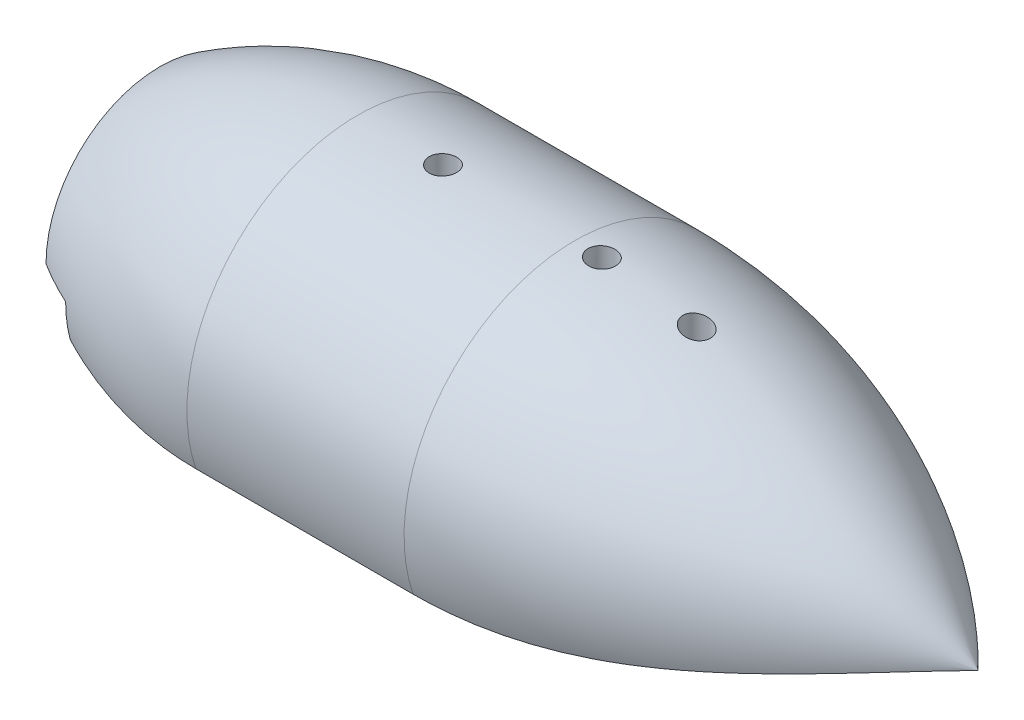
SolidWorks part; units mm, degrees
ref_plane "Front Plane" through (0, 0, 0) normal (0, 0, 1) x (1, 0, 0)
ref_plane "Top Plane" through (0, 0, 0) normal (0, 1, 0) x (1, 0, 0)
ref_plane "Right Plane" through (0, 0, 0) normal (1, 0, 0) x (0, 0, -1)
sketch "Sketch2" plane through (0, 0, 0) normal (1, 0, 0) x (0, 0, -1)
  circle A0 centre (0, 0) radius 18.288
  dimension "D1" = 36.576
extrude "Extrude1" add sketch "Sketch2" along normal blind 87.63
sketch "Sketch3" plane through (0, 0, 0) normal (0, 0, 1) x (1, 0, 0)
  line L0 (87.63, -18.288) -> (87.63, 18.288) construction
  line L2 (44.45, 0) -> (44.45, 18.288) construction
  line L3 (87.63, 18.288) -> (0, 18.288) construction
  line L4 (87.63, 0.0088) -> (87.63, 18.288)
  line L5 (87.63, 18.288) -> (44.45, 18.288)
  line L6 (0, 0) -> (21.1849, 0) construction
  line L7 (21.1849, 0) -> (21.1849, 18.288) construction
  line L8 (0, 0) -> (0, 12.192) construction
  line L9 (0, 18.288) -> (0, -18.288) construction
  line L10 (21.1849, 18.288) -> (0, 18.288)
  line L11 (0, 18.288) -> (0, 12.192)
  arc A0 (44.45, 18.288) -> (87.63, 0.0088) centre (44.45, -41.8525) cw
  arc A1 (21.1849, 18.288) -> (0, 12.192) centre (21.1849, -21.5709) ccw
  dimension "D1" = 12.192
revolve "shape" cut sketch "Sketch3" angle 360 about L6
sketch "Sketch5" plane through (0, 0, 0) normal (-1, 0, 0) x (0, 0, 1)
  circle A0 centre (0, 0) radius 7.9375
  dimension "D1" = 15.875
extrude "Cut-Extrude2" cut sketch "Sketch5" against normal blind 24.13
sketch "Sketch4" plane through (0, 0, 0) normal (-1, 0, 0) x (0, 0, 1)
  line L0 (0, -20.6375) -> (0, 0) construction
  line L1 (16.3949, -8.103) -> (-16.3949, -8.103)
  line L2 (0, -20.6375) -> (16.3949, -8.103) construction
  line L3 (16.3949, -8.103) -> (16.3949, -20.6375)
  line L4 (16.3949, -20.6375) -> (-16.3949, -20.6375)
  line L5 (-16.3949, -20.6375) -> (-16.3949, -8.103)
  circle A1 centre (0, 0) radius 18.288 construction
  dimension "D1" = 20.6375
  dimension "D2" = 20.6375
extrude "Cut-Extrude1" cut sketch "Sketch4" against normal through all
sketch "Sketch8" plane through (0, 0, 0) normal (0, 1, 0) x (1, 0, 0)
  line L0 (26.2128, 3.2946) -> (26.2128, 11.8036)
  line L1 (26.2128, 3.2946) -> (34.4678, 3.2946)
  line L2 (18.923, 11.8036) -> (26.2128, 11.8036)
  line L3 (26.2128, -3.3094) -> (34.4678, -3.3094)
  line L4 (18.923, 11.8036) -> (18.923, -11.8184)
  line L5 (18.923, -11.8184) -> (26.2128, -11.8184)
  line L6 (26.2128, -11.8184) -> (26.2128, -3.3094)
  line L7 (34.4678, 11.8036) -> (42.3418, 11.8036)
  line L8 (34.4678, -11.8184) -> (34.4678, -3.3094)
  line L9 (34.4678, -11.8184) -> (42.3418, -11.8184)
  line L10 (42.3418, 11.8036) -> (42.3418, -11.8184)
  line L11 (34.4678, 3.2946) -> (34.4678, 11.8036)
  line L12 (42.3418, -0.0074) -> (18.923, -0.0074) construction
  line L13 (0, 0) -> (92.1788, -0.0362) construction
  line L14 (0, 12.192) -> (0, -12.192) construction
  line L15 (26.2128, 3.2946) -> (26.2128, -3.3094) construction
  point P20 (26.2128, -0.0074)
  dimension "D1" = 7.2898
  dimension "D2" = 7.874
  dimension "D3" = 8.255
  dimension "D4" = 18.923
  dimension "D5" = 23.622
  dimension "D6" = 6.604
extrude "camera base and transmitter" cut sketch "Sketch8" along normal blind 12.954 and the other way through all
fillet "Fillet1" radius 1.5875 8 edges at (42.3418, 2.4255, -11.8036) (34.4678, 2.4255, -11.8036) (26.2128, 2.4255, -11.8036) (18.923, 2.4255, -11.8036) (42.3418, 2.4255, 11.8184) (34.4678, 2.4255, 11.8184) (26.2128, 2.4255, 11.8184) (18.923, 2.4255, 11.8184)
sketch "r" plane through (0, 0, 0) normal (0, 1, 0) x (1, 0, 0)
  line L1 (65.7098, -0.0074) -> (42.3418, -0.0074) construction
  line L2 (42.3418, 3.1676) -> (42.3418, -3.1824)
  line L3 (42.3418, -3.1824) -> (65.7098, -3.1824)
  line L4 (65.7098, 3.1676) -> (65.7098, -3.1824)
  line L5 (42.3418, 3.1676) -> (65.7098, 3.1676)
  line L6 (42.3418, -10.2309) -> (42.3418, 10.2161) construction
  line L7 (42.3418, -10.2309) -> (42.3418, 10.2161) construction
  dimension "D1" = 6.35
  dimension "D2" = 23.368
extrude "tab slot" cut sketch "r" along normal blind 10.16 and the other way through all
sketch "Sketch9" plane through (18.923, 0, 0) normal (1, 0, 0) x (0, 0, -1)
  line L1 (-7.874, 7.874) -> (7.874, 7.874)
  line L2 (-7.874, 7.874) -> (-7.874, -2.6762)
  line L3 (-7.874, -2.6762) -> (7.874, -2.6762)
  line L4 (7.874, 7.874) -> (7.874, -2.6762)
extrude "Cut-Extrude6" cut sketch "Sketch9" against normal blind 5.588
sketch "Sketch10" plane through (0, 0, 0) normal (0, 1, 0) x (1, 0, 0)
  line L0 (0, 12.192) -> (0, -12.192) construction
  line L1 (0, -12.7042) -> (10.9133, -12.7042)
  line L2 (0, -12.7042) -> (0, 12.8228)
  line L3 (0, 12.8228) -> (10.9133, 12.8228)
  line L4 (10.9133, -12.7042) -> (10.9133, -7.874)
  line L5 (15.1084, 0.0593) -> (0, 0.0593) construction
  line L6 (18.923, 10.2161) -> (18.923, -10.2309) construction
  line L7 (10.9133, -7.874) -> (18.923, -7.874)
  line L8 (18.923, -7.874) -> (18.923, 7.874)
  line L9 (18.923, 7.874) -> (10.9133, 7.874)
  line L11 (10.9133, 7.874) -> (10.9133, 12.8228)
  line L12 (10.9133, -7.874) -> (10.9133, 7.874) construction
  dimension "D1" = 25.527
extrude "holder interface" cut sketch "Sketch10" against normal through all
sketch "Sketch11" plane through (0, 0, 0) normal (0, 0, 1) x (1, 0, 0)
  line L0 (0, 12.192) -> (0, 0) construction
  line L1 (0, -7.3177) -> (4.572, -7.3177)
  line L2 (0, -7.3177) -> (0, 0)
  line L3 (0, 0) -> (4.572, 0)
  line L4 (4.572, -7.3177) -> (4.572, 0)
  line L5 (0.8391, 0) -> (10.9133, 0) construction
  point P6 (0.8391, 0)
  point P7 (5.491, -8.103)
  dimension "D1" = 4.572
extrude "Cut-Extrude8" cut sketch "Sketch11" against normal through all and the other way through all
fillet "Fillet2" radius 3.175 2 edges at (13.335, 4.438, 7.874) (13.335, 4.438, -7.874)
fillet "Fillet3" radius 3.175 2 edges at (65.7098, 1.0285, 3.1824) (65.7098, 1.0285, -3.1676)
sketch "Sketch13" plane through (0, 12.954, 0) normal (0, -1, 0) x (1, 0, 0)
  line L3 (26.2128, 3.3094) -> (26.2128, -3.2946) construction
  line L4 (34.4678, 3.3094) -> (34.4678, -3.2946) construction
  line L5 (34.4678, 0.0074) -> (26.2128, 0.0074) construction
sketch "Sketch14" plane through (0, 10.16, 0) normal (0, -1, 0) x (1, 0, 0)
  line L0 (65.7098, 0.0074) -> (34.4678, 0.0074) construction
  line L1 (34.4678, -10.2161) -> (34.4678, -3.2946) construction
  line L2 (34.4678, 3.3094) -> (34.4678, -3.2946) construction
hole_wizard "#4 Clearance Hole1" positions "3DSketch1" profile "Sketch12" hole size "#4" standard "Ansi Inch"
sketch3d "3DSketch1"
  line L1 (65.7098, 10.16, 0.0074) -> (34.4678, 10.16, 0.0074) construction
  line L2 (34.4678, 12.954, 0.0074) -> (26.2128, 12.954, 0.0074) construction
  point P0 (30.3403, 12.954, 0.0074)
  point P2 (47.3583, 10.16, 0.0074)
  point P4 (57.5183, 10.16, 0.0074)
  dimension "D1" = 10.16
  dimension "D2" = 12.8905
sketch "Sketch12" plane through (30.3403, 12.954, 0.0074) normal (1, 0, 0) x (0, 0, -1)
  line L0 (0, 0) -> (0, 5.334)
  line L1 (0, 5.334) -> (1.4732, 5.334)
  line L2 (1.4732, 5.334) -> (1.4732, 0)
  line L5 (1.4732, 0) -> (0, 0)
  line L11 (0, -6.35) -> (0, 107.95) construction
  dimension "Thru Hole Dia." = 2.9464
  dimension "Thru Hole Depth" = 5.334
fillet "Fillet4" radius 2.54 2 edges at (10.9133, -4.0515, -12.8228) (10.9133, -4.0515, 12.7042)
sketch "Sketch15" plane through (0, -8.103, 0) normal (0, -1, 0) x (1, 0, 0)
  circle A0 centre (38.792, 0.0074) radius 4.7625
  dimension "D1" = 9.525
extrude "Cut-Extrude9" cut sketch "Sketch15" against normal offset from surface (22.835 mm away) 1.778
sketch "Sketch16" plane through (0, 0, 0) normal (-1, 0, 0) x (0, 0, 1)
  circle A0 centre (0, -28.575) radius 28.575
  dimension "D1" = 57.15
extrude "Cut-Extrude10" cut sketch "Sketch16" against normal through all
